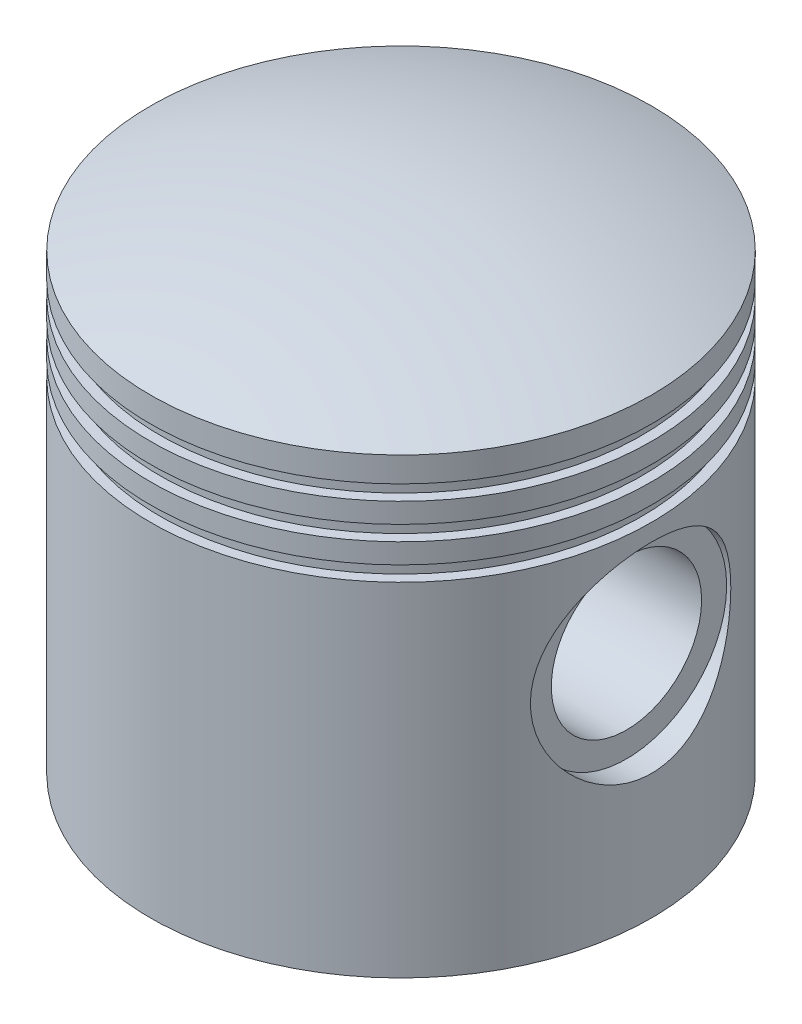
SolidWorks part; units mm, degrees
ref_plane "Front Plane" through (0, 0, 0) normal (0, 0, 1) x (1, 0, 0)
ref_plane "Top Plane" through (0, 0, 0) normal (0, 1, 0) x (1, 0, 0)
ref_plane "Right Plane" through (0, 0, 0) normal (1, 0, 0) x (0, 0, -1)
sketch "Sketch1" plane through (0, 0, 0) normal (0, 0, 1) x (1, 0, 0)
  line L0 (0, 0) -> (0, 114.4149) construction
  line L1 (0, 84) -> (37.5, 84)
  line L2 (37.5, 84) -> (37.5, 20)
  line L3 (37.5, 20) -> (43, 20)
  line L4 (43, 20) -> (43, 0)
  line L5 (43, 0) -> (50, 0)
  line L6 (50, 0) -> (50, 68.3994)
  line L7 (50, 68.3994) -> (48, 68.3994)
  line L8 (48, 68.3994) -> (48, 71.3994)
  line L9 (48, 71.3994) -> (50, 71.3994)
  line L10 (50, 71.3994) -> (50, 75.3994)
  line L11 (50, 75.3994) -> (48, 75.3994)
  line L12 (48, 75.3994) -> (48, 78.3994)
  line L13 (48, 78.3994) -> (50, 78.3994)
  line L14 (50, 78.3994) -> (50, 82.3994)
  line L15 (50, 82.3994) -> (48, 82.3994)
  line L16 (48, 82.3994) -> (48, 85.3994)
  line L17 (48, 85.3994) -> (50, 85.3994)
  line L18 (50, 85.3994) -> (50, 90.3994)
  line L19 (0, 100) -> (0, 84)
  arc A0 (50, 90.3994) -> (0, 100) centre (0, -35) ccw
  dimension "D9" = 135
  dimension "D1" = 75
  dimension "D2" = 86
  dimension "D3" = 100
  dimension "D4" = 20
  dimension "D5" = 3
  dimension "D6" = 4
  dimension "D7" = 2
  dimension "D8" = 5
  dimension "D10" = 100
  dimension "D11" = 16
revolve "Revolve1" add sketch "Sketch1" angle 360 about L0
sketch "Sketch2" plane through (0, 0, 0) normal (1, 0, 0) x (0, 0, -1)
  circle A0 centre (0, 45) radius 15
  dimension "D1" = 30
  dimension "D2" = 45
extrude "Cut-Extrude1" cut sketch "Sketch2" against normal through all both and the other way through all
ref_plane "Plane1" through (20, 0, 0) normal (1, 0, 0) x (0, 0, -1)
sketch "Sketch3" plane through (20, 0, 0) normal (1, 0, 0) x (0, 0, -1)
  circle A0 centre (0, 45) radius 20
  circle A1 centre (0, 45) radius 15
  circle A2 centre (0, 45) radius 15 construction
  dimension "D1" = 40
extrude "Boss-Extrude1" add sketch "Sketch3" along normal up to next
mirror "Mirror1" about plane through (0, 0, 0) normal (1, 0, 0) of "Boss-Extrude1"
ref_plane "Plane2" through (50, 0, 0) normal (1, 0, 0) x (0, 0, -1)
sketch "Sketch4" plane through (50, 0, 0) normal (1, 0, 0) x (0, 0, -1)
  circle A0 centre (0, 45) radius 15
  circle A1 centre (0, 45) radius 20
  circle A2 centre (0, 45) radius 15 construction
  dimension "D1" = 40
extrude "Cut-Extrude2" cut sketch "Sketch4" against normal blind 5
mirror "Mirror2" about plane through (0, 0, 0) normal (1, 0, 0) of "Cut-Extrude2"
